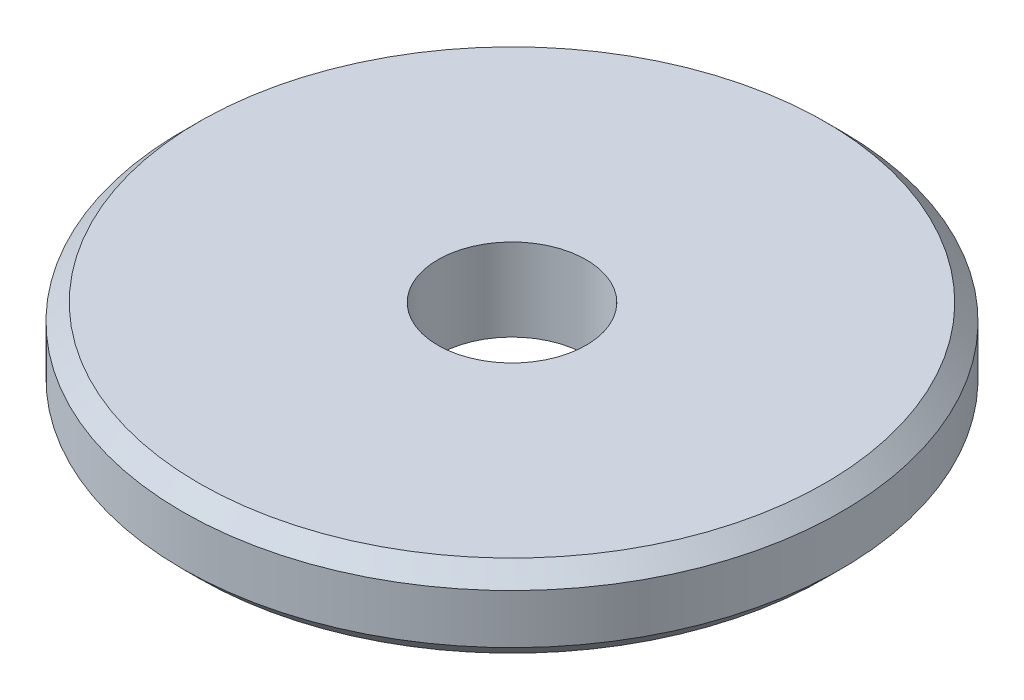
SolidWorks part; units mm, degrees
ref_plane "Front Plane" through (0, 0, 0) normal (0, 0, 1) x (1, 0, 0)
ref_plane "Top Plane" through (0, 0, 0) normal (0, 1, 0) x (1, 0, 0)
ref_plane "Right Plane" through (0, 0, 0) normal (1, 0, 0) x (0, 0, -1)
sketch "Sketch1" plane through (0, 0, 0) normal (0, 1, 0) x (1, 0, 0)
  circle A0 centre (0, 0) radius 20
  circle A1 centre (0, 0) radius 4.5
  dimension "D1" = 9
  dimension "D2" = 40
extrude "Extrude1" add sketch "Sketch1" along normal blind 5
chamfer "Chamfer1" distance 1 angle 45 2 edges at (0, 0, 20) (0, 5, 20)
